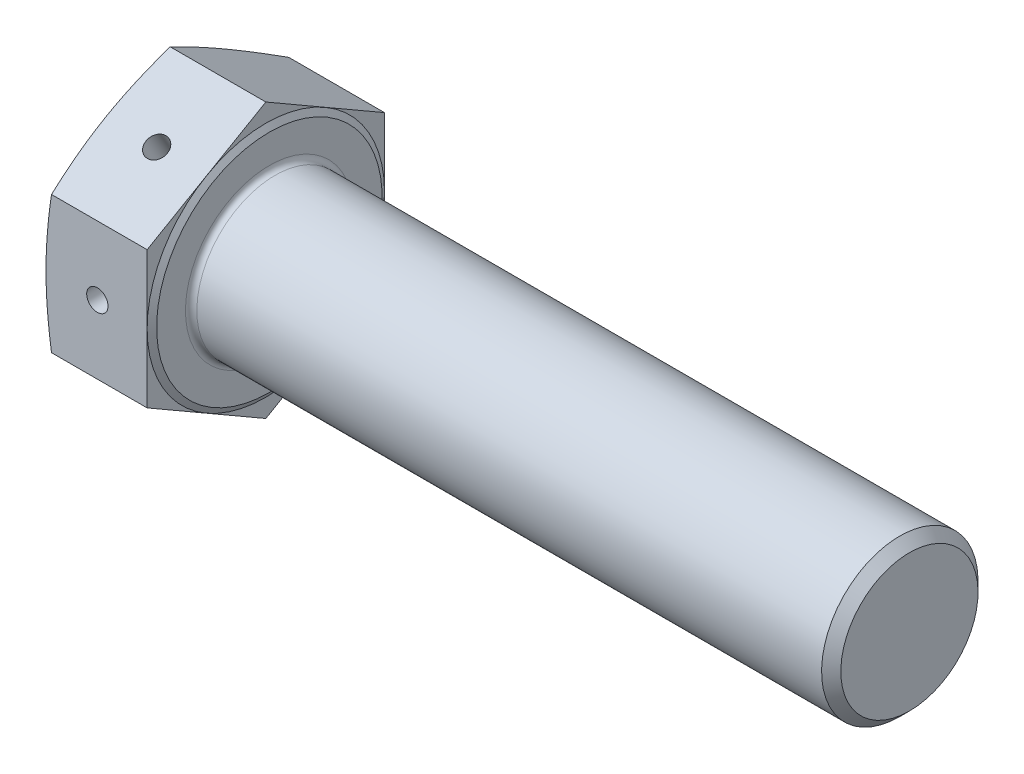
SolidWorks part; units mm, degrees
ref_plane "Front" through (0, 0, 0) normal (0, 0, 1) x (1, 0, 0)
ref_plane "Top" through (0, 0, 0) normal (0, 1, 0) x (1, 0, 0)
ref_plane "Right" through (0, 0, 0) normal (1, 0, 0) x (0, 0, -1)
sketch "Sketch-BaseHead" plane through (0, 0, 0) normal (1, 0, 0) x (0, 0, -1)
  line L1 (0, -19.272) -> (16.69, -9.636)
  line L2 (16.69, -9.636) -> (16.69, 9.636)
  line L3 (16.69, 9.636) -> (0, 19.272)
  line L4 (0, 19.272) -> (-16.69, 9.636)
  line L5 (-16.69, 9.636) -> (-16.69, -9.636)
  line L6 (-16.69, -9.636) -> (0, -19.272)
  circle A0 centre (0, 0) radius 16.69 construction
  dimension "s" = 33.38
extrude "BaseHead" add sketch "Sketch-BaseHead" along normal blind 14.22
sketch "Sketch4" plane through (-0.2646, -5.9169, 0) normal (0, 0, 1) x (0, 1, 0)
  line L0 (5.9169, 3.7369) -> (5.9169, -10.4477) construction
  line L2 (25.1888, -0.2646) -> (22.6069, -0.2646)
  line L4 (22.6069, -0.2646) -> (25.1888, -1.0388)
  line L6 (25.1888, -1.0388) -> (25.1888, -0.2646)
  dimension "D1" = 16.69
  dimension "D2" = 33.38
revolve "HeadChamfer" cut sketch "Sketch4" angle 360 about L0
sketch "Sketch2" plane through (0, 0, 0) normal (0, 1, 0) x (1, 0, 0)
  line L0 (14.22, 0) -> (14.72, 0)
  line L1 (14.72, 0) -> (14.72, 15.855)
  line L2 (14.72, 15.855) -> (14.22, 16.69)
  line L3 (14.22, 16.69) -> (14.22, 0)
  line L4 (14.22, 16.69) -> (14.22, 0) construction
  dimension "D1" = 16.69
  dimension "D2" = 15.855
  dimension "c" = 0.5
revolve "Revolve1" add sketch "Sketch2" angle 360 about axis through (-4.0016, 0, 0) along (1, 0, 0)
ref_plane "Plane2" through (54.72, 0, 0) normal (1, 0, 0) x (0, 0, -1)
sketch "Sketch3" plane through (14.72, 0, 0) normal (1, 0, 0) x (0, 0, -1)
  circle A0 centre (0, 0) radius 11
  dimension "d" = 22
extrude "BaseBody" add sketch "Sketch3" along normal blind 90
chamfer "Chamfer1" distance 1.353 angle 45 1 edges at (104.72, 11, 0)
fillet "HeadFillet" radius 0.8 1 edges at (14.72, -11, 0)
sketch "Sketch5" plane through (0, 0, 0) normal (0, 0, 1) x (1, 0, 0)
  line L1 (14.22, -14.454) -> (14.22, -19.272) construction
  line L2 (-4.0016, 0) -> (10.1831, 0) construction
  circle A0 centre (7.22, 0) radius 1.5
  dimension "d1" = 3
  dimension "h" = 7
extrude "Hole" cut sketch "Sketch5" against normal through all and the other way through all
pattern_circular "CirPattern1" count 2 over 60 about axis through (104.72, 0, 0) along (-1, 0, 0) of "Hole"
equation "\"D1@Sketch4\" = \"s@Sketch-BaseHead\"/ 2 "
equation "\"D2@Sketch4\" = \"s@Sketch-BaseHead\""
equation "\"D1@Chamfer1\" =  ( \"d@Sketch3\" - \"D2@ThreadCosmetic1\" ) / 2 "
equation "\"b@ThreadCosmetic1\" = \"l@BaseBody\" - \"lg@Plane2\""
equation "\"D1@Sketch2\"=\"s@Sketch-BaseHead\"/2"
